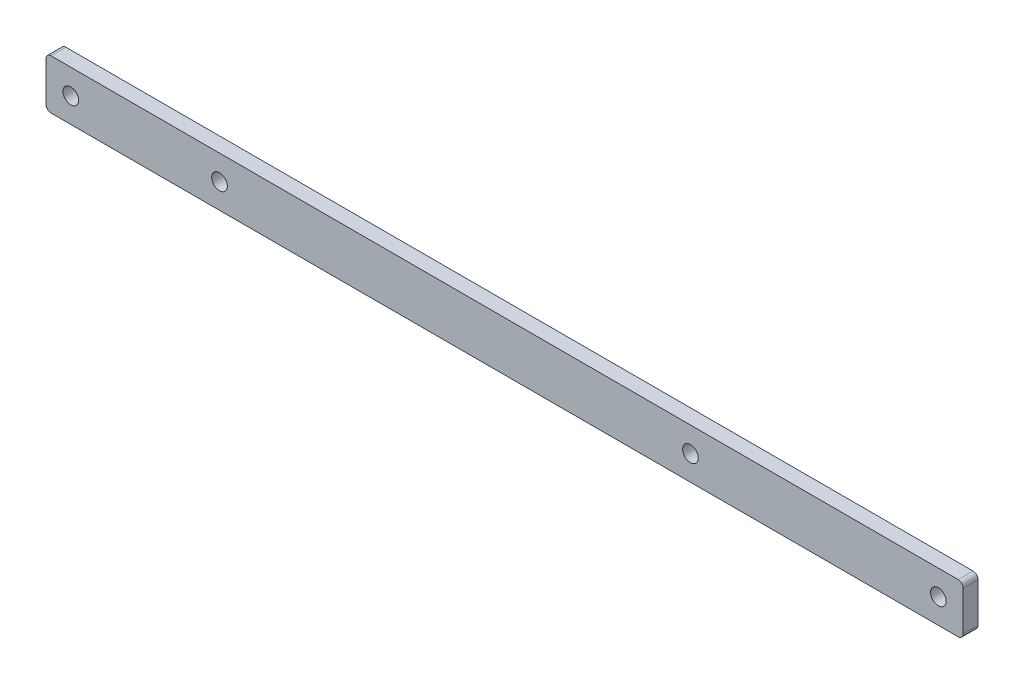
SolidWorks part; units mm, degrees
ref_plane "Front Plane" through (0, 0, 0) normal (0, 0, 1) x (1, 0, 0)
ref_plane "Top Plane" through (0, 0, 0) normal (0, 1, 0) x (1, 0, 0)
ref_plane "Right Plane" through (0, 0, 0) normal (1, 0, 0) x (0, 0, -1)
sketch "Sketch1" plane through (0, 0, 0) normal (0, 0, 1) x (1, 0, 0)
  line L1 (0, 0) -> (469.9, 0)
  line L2 (0, 0) -> (0, 25.4)
  line L3 (0, 25.4) -> (469.9, 25.4)
  line L4 (469.9, 0) -> (469.9, 25.4)
  dimension "D1" = 25.4
  dimension "D2" = 469.9
extrude "Boss-Extrude1" add sketch "Sketch1" along normal blind 7.62
sketch "Sketch2" plane through (0, 0, 7.62) normal (0, 0, 1) x (1, 0, 0)
  line L0 (469.9, 12.7) -> (0, 12.7) construction
  line L1 (469.9, 0) -> (469.9, 25.4) construction
  line L2 (0, 25.4) -> (0, 0) construction
  circle A0 centre (12.7, 12.7) radius 4
  dimension "D1" = 8
  dimension "D2" = 12.7
extrude "Cut-Extrude1" cut sketch "Sketch2" against normal through all
ref_plane "Plane1" through (234.95, 0, 0) normal (1, 0, 0) x (0, 0, -1)
mirror "Mirror1" about plane through (234.95, 0, 0) normal (1, 0, 0) of "Cut-Extrude1"
fillet "Fillet1" radius 2.54 4 edges at (0, 25.4, 3.81) (0, 0, 3.81) (469.9, 0, 3.81) (469.9, 25.4, 3.81)
sketch "Sketch3" plane through (0, 0, 7.62) normal (0, 0, 1) x (1, 0, 0)
  line L0 (0, 12.7) -> (469.9, 12.7) construction
  line L1 (0, 22.86) -> (0, 2.54) construction
  line L2 (469.9, 2.54) -> (469.9, 22.86) construction
  line L3 (88.9, 25.4) -> (88.9, 0) construction
  line L4 (467.36, 25.4) -> (2.54, 25.4) construction
  line L5 (2.54, 0) -> (467.36, 0) construction
  line L6 (330.2, 25.4) -> (330.2, 0) construction
  circle A0 centre (88.9, 12.7) radius 4
  circle A1 centre (12.7, 12.7) radius 4 construction
  circle A2 centre (330.2, 12.7) radius 4
  circle A4 centre (457.2, 12.7) radius 4 construction
  dimension "D1" = 76.2
  dimension "D2" = 8
  dimension "D3" = 127
extrude "Cut-Extrude2" cut sketch "Sketch3" against normal through all
